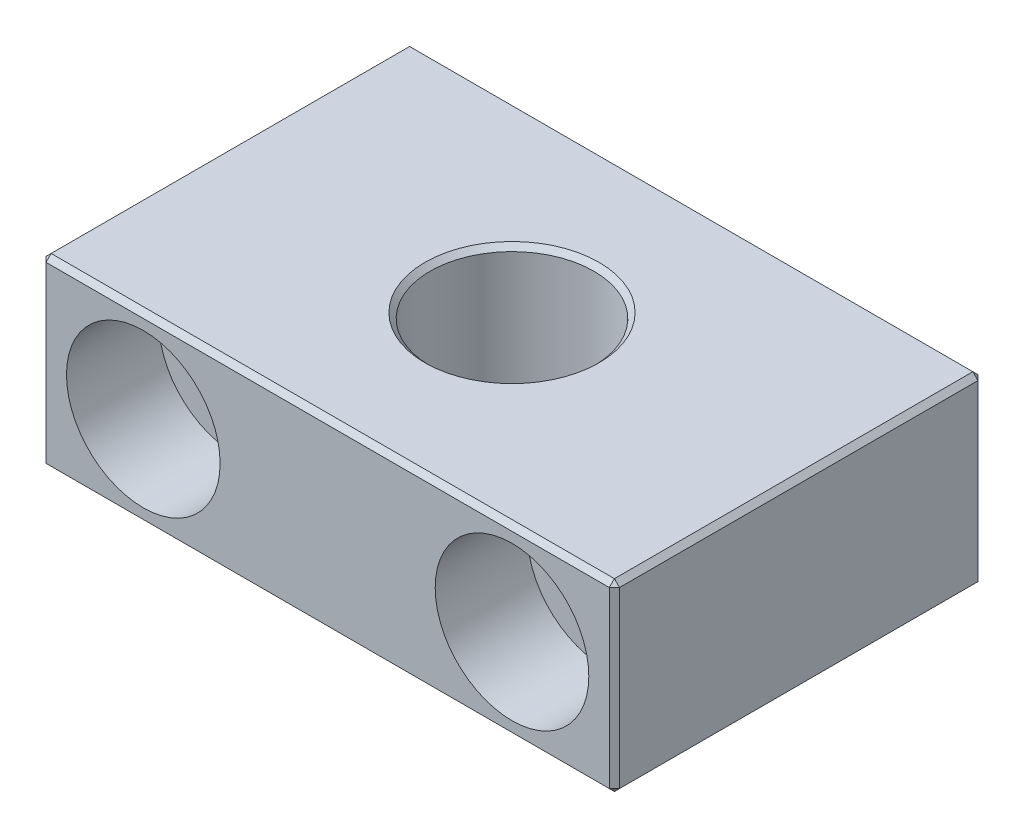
SolidWorks part; units mm, degrees
ref_plane "Спереди" through (0, 0, 0) normal (0, 0, 1) x (1, 0, 0)
ref_plane "Сверху" through (0, 0, 0) normal (0, 1, 0) x (1, 0, 0)
ref_plane "Справа" through (0, 0, 0) normal (1, 0, 0) x (0, 0, -1)
sketch "Эскиз1" plane through (0, 0, 0) normal (0, 0, 1) x (1, 0, 0)
  line L1 (-28, 9) -> (28, 9)
  line L2 (-28, 9) -> (-28, -9)
  line L3 (-28, -9) -> (28, -9)
  line L4 (28, 9) -> (28, -9)
  line L5 (-28, 9) -> (28, -9) construction
  line L6 (-28, -9) -> (28, 9) construction
  point P0 (0, 0)
  dimension "D1" = 56
  dimension "D2" = 18
extrude "Бобышка-Вытянуть1" add sketch "Эскиз1" along normal blind 36
other "Отверстие1"
sketch "Эскиз2" plane through (0, 0, 36) normal (0, 0, 1) x (1, 0, 0)
  line L0 (-18, -0.01) -> (18, -0.01) construction
  line L1 (0, -0.01) -> (0, 0) construction
  circle A0 centre (-18, -0.01) radius 4.5
  circle A1 centre (18, -0.01) radius 4.5
  dimension "D1" = 9
  dimension "D3" = 0.01
  dimension "D2" = 36
other "Отверстие2" parameters "D1"=21
sketch "Эскиз15" plane through (0, 9, 0) normal (0, 1, 0) x (1, 0, 0)
  circle A0 centre (0, -18) radius 8
  dimension "D1" = 16
  dimension "D2" = 18
hole_wizard "Отверстие обработанное метчиком M61" positions "Эскиз14" profile "Эскиз13" tap size "M6" standard "GOST"
sketch "Эскиз14" plane through (0, 0, 32) normal (0, 0, 1) x (1, 0, 0)
  point P0 (0, 1.5)
  dimension "D1" = 1.5
sketch "Эскиз13" plane through (0, 1.5, 32) normal (1, 0, 0) x (0, -1, 0)
  line L0 (0, 0) -> (0, 7)
  line L1 (0, 7) -> (2.5, 7)
  line L2 (2.5, 7) -> (2.5, 0.525)
  line L3 (2.5, 0.525) -> (3.025, 0)
  line L5 (3.025, 0) -> (0, 0)
  line L6 (-2.5, 0.525) -> (-3.025, 0) construction
  line L11 (0, -6.35) -> (0, 107.95) construction
  dimension "Диаметр проходного сверла" = 5
  dimension "Глубина проходного сверла" = 7
  dimension "Диаметр передней зенковки" = 6.05
  dimension "Угол передней зенковки" = 90
sketch "Эскиз5" [suppressed] plane through (0, 0, 36) normal (0, 0, 1) x (1, 0, 0)
  line L1 (-32.5, 10.49) -> (-21, 10.49)
  line L2 (-32.5, 10.49) -> (-32.5, -10.51)
  line L3 (-32.5, -10.51) -> (-21, -10.51)
  line L4 (32.5, 10.49) -> (32.5, -10.51)
  line L6 (21, -10.51) -> (32.5, -10.51)
  line L7 (21, 10.49) -> (32.5, 10.49)
  line L9 (-32.5, 10) -> (-32.5, -10) construction
  line L10 (32.5, -10) -> (32.5, 10) construction
  arc A0 (-21, -10.51) -> (-21, 10.49) centre (-21, -0.01) ccw
  arc A1 (21, 10.49) -> (21, -10.51) centre (21, -0.01) ccw
  dimension "D1" = 21
extrude "Вырез-Вытянуть1" [suppressed] cut sketch "Эскиз5" against normal blind 11
chamfer "Фаска2" [suppressed] distance 2 angle 90
sketch "Эскиз16" [suppressed] plane through (0, 0, 0) normal (0, 0, 1) x (1, 0, 0)
  line L0 (0, 0) -> (0, 8.5) construction
  line L1 (-15, 11.5) -> (15, 11.5)
  line L2 (-15, 11.5) -> (-15, 8.5)
  line L3 (-15, 8.5) -> (15, 8.5)
  line L4 (15, 11.5) -> (15, 8.5)
  line L6 (33, 11.5) -> (-33, 11.5) construction
  dimension "D1" = 3
  dimension "D2" = 30
extrude "Вырез-Вытянуть3" [suppressed] cut sketch "Эскиз16" along normal through all
hole_wizard "CBORE for  Hex Socket Head Cap Screw Class A 117380" positions "Эскиз7" profile "Эскиз6" counterbore size "M8" standard "GOST"
sketch "Эскиз7" plane through (0, 0, 36) normal (0, 0, 1) x (1, 0, 0)
  point P0 (-18, -0.01)
  point P2 (18, -0.01)
sketch "Эскиз6" plane through (-18, -0.01, 36) normal (1, 0, 0) x (0, -1, 0)
  line L0 (0, 0) -> (0, 36)
  line L1 (0, 36) -> (4.5, 36)
  line L3 (4.5, 36) -> (4.5, 9)
  line L4 (4.5, 9) -> (7.5, 9)
  line L5 (7.5, 9) -> (7.5, 0)
  line L7 (7.5, 0) -> (0, 0)
  line L11 (0, -6.35) -> (0, 107.95) construction
  dimension "Диаметр сквозного отверстия" = 9
  dimension "Глубина сквозного отверстия" = 36
  dimension "Диаметр цековки" = 15
  dimension "Глубина цековки" = 9
ref_plane "Плоскость1" [suppressed] through (0, 1.5, 0) normal (0, 1, 0) x (1, 0, 0)
sketch "Эскиз12" [suppressed] plane through (0, 1.5, 0) normal (0, 1, 0) x (1, 0, 0)
  circle A0 centre (0, -15) radius 10.5
  circle A3 centre (0, -15) radius 10 construction
  dimension "D1" = 0.5
extrude "Вырез-Вытянуть2" [suppressed] cut sketch "Эскиз12" against normal mid plane 2
fillet "Скругление1" [suppressed] radius 0.5
chamfer "Фаска3" distance 0.5 angle 45 14 edges at (28, 9, 18) (-28, 9, 18) (0, 9, 26) (-28, -9, 18) (28, -9, 18) (0, -9, 0) (0, -9, 26) (28, 0, 0) (-28, 0, 0) (28, 0, 36) (-28, 0, 36) (0, 9, 36) (0, 9, 0) (0, -9, 36)
chamfer "Фаска5" [suppressed] distance 0.5 angle 45
